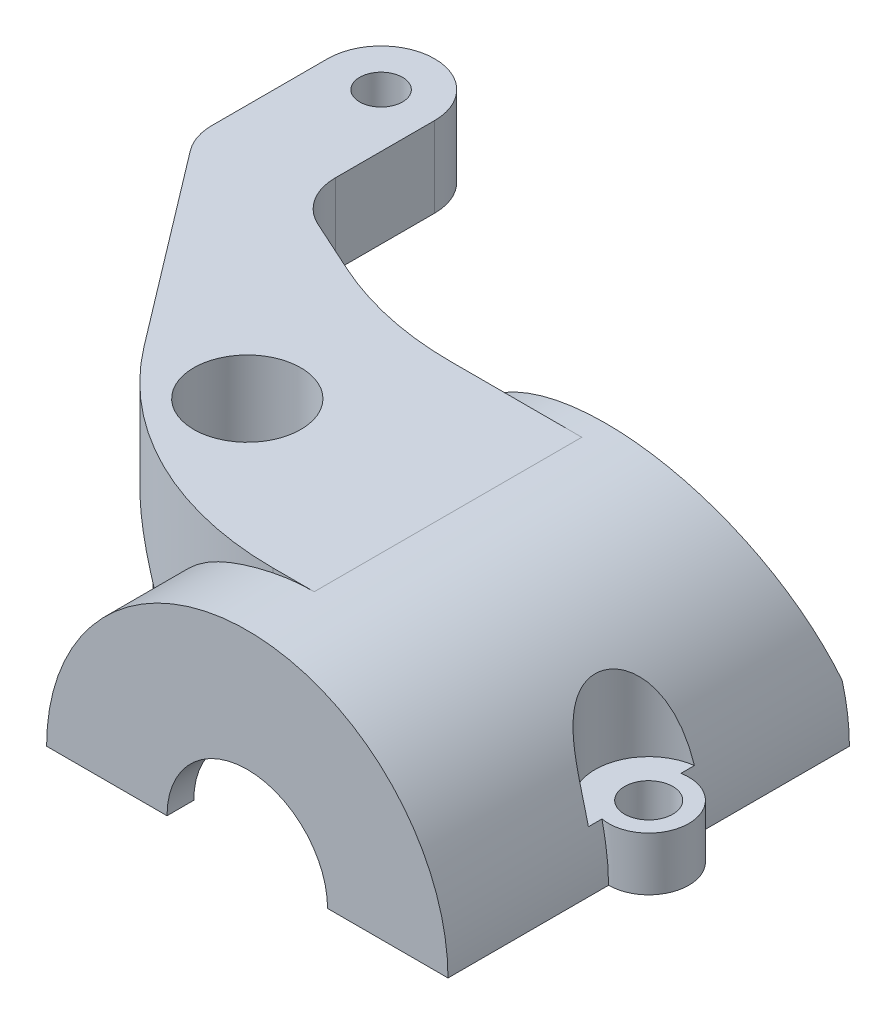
SolidWorks part; units mm, degrees
ref_plane "Front Plane" through (0, 0, 0) normal (0, 0, 1) x (1, 0, 0)
ref_plane "Top Plane" through (0, 0, 0) normal (0, 1, 0) x (1, 0, 0)
ref_plane "Right Plane" through (0, 0, 0) normal (1, 0, 0) x (0, 0, -1)
sketch "Sketch1" plane through (0, 0, 0) normal (0, 0, 1) x (1, 0, 0)
  circle A0 centre (0, 0) radius 9.525
  dimension "D1" = 19.05
extrude "Boss-Extrude1" add sketch "Sketch1" along normal blind 31.75
sketch "Sketch2" plane through (0, 0, 0) normal (0, 1, 0) x (1, 0, 0)
  line L0 (9.525, 0) -> (-9.525, 0) construction
  circle A0 centre (0, -6.35) radius 6.35
  dimension "D1" = 12.7
  dimension "D2" = 6.35
extrude "Boss-Extrude3" add sketch "Sketch2" along normal mid plane 19.05
sketch "Sketch3" plane through (0, 0, 0) normal (0, 1, 0) x (1, 0, 0)
  line L0 (-6.35, -6.35) -> (-9.525, -12.7)
  line L1 (-9.525, 0) -> (-9.525, -31.75) construction
  line L2 (-9.525, -12.7) -> (-12.728, -12.7)
  line L3 (-12.728, -12.7) -> (-12.728, 2.5774)
  line L4 (-12.728, 2.5774) -> (12.728, 2.5774)
  line L5 (12.728, 2.5774) -> (12.728, -12.7)
  line L6 (12.728, -12.7) -> (9.4319, -12.7)
  line L8 (6.35, -6.35) -> (9.4319, -12.7)
  arc A1 (6.35, -6.35) -> (-6.35, -6.35) centre (0, -6.35) ccw
extrude "Cut-Extrude1" cut sketch "Sketch3" against normal mid plane 19.05
sketch "Sketch17" plane through (0, 0, 0) normal (0, 1, 0) x (1, 0, 0)
  circle A0 centre (0, -6.35) radius 6.35
extrude "Boss-Extrude5" add sketch "Sketch17" against normal blind 10.16
sketch "Sketch18" plane through (0, 0, 0) normal (1, 0, 0) x (0, 0, -1)
  line L0 (-12.7, -10.16) -> (0, -10.16) construction
  line L1 (0.619, 11.9651) -> (-12.6697, 11.9651)
  line L2 (0.619, 11.9651) -> (0.619, 2.54)
  line L3 (0.619, 2.54) -> (-12.7, 2.54)
  line L5 (-12.7, 2.54) -> (-14.732, 9.525)
  line L6 (-12.7, 9.525) -> (-31.75, 9.525) construction
  line L7 (-14.732, 9.525) -> (-14.732, 11.9651)
  line L8 (-14.732, 11.9651) -> (-12.6697, 11.9651)
  dimension "D1" = 12.7
  dimension "D2" = 2.032
  dimension "D3" = 12.7
extrude "Cut-Extrude9" cut sketch "Sketch18" against normal through all both and the other way through all
sketch "Sketch19" plane through (0, -10.16, 0) normal (0, -1, 0) x (1, 0, 0)
  circle A0 centre (0, 6.35) radius 2.54
  dimension "D1" = 5.08
extrude "Cut-Extrude10" cut sketch "Sketch19" against normal through all
sketch "Sketch20" plane through (0, 0, 0) normal (1, 0, 0) x (0, 0, -1)
  line L0 (-32.7805, 0) -> (-32.7805, -11.6042)
  line L1 (-32.7805, 0) -> (-12.7, 0)
  line L4 (-12.7, 0) -> (-12.7, 4.1218)
  line L5 (-32.7805, -11.6042) -> (2.1772, -11.6042)
  line L6 (2.1772, -11.6042) -> (2.1772, 4.1218)
  line L7 (2.1772, 4.1218) -> (-12.7, 4.1218)
extrude "Cut-Extrude11" cut sketch "Sketch20" against normal through all both and the other way through all
sketch "Sketch21" plane through (0, 0, 0) normal (0, -1, 0) x (1, 0, 0)
  line L0 (3.81, 31.75) -> (3.81, 30.48)
  line L1 (9.525, 31.75) -> (-9.525, 31.75) construction
  line L2 (3.81, 30.48) -> (7.9375, 30.48)
  line L3 (7.9375, 30.48) -> (7.9375, 25.4)
  line L4 (7.9375, 25.4) -> (6.35, 25.4)
  line L5 (6.35, 25.4) -> (6.35, 15.24)
  line L6 (6.35, 15.24) -> (0, 15.24)
  line L7 (0, 33.6612) -> (0, 5.9676) construction
  line L8 (3.81, 31.75) -> (0, 31.75)
  line L9 (0, 15.24) -> (0, 31.75)
  dimension "D1" = 3.81
  dimension "D2" = 7.9375
  dimension "D3" = 6.35
  dimension "D4" = 5.08
  dimension "D5" = 10.16
  dimension "D6" = 1.27
sketch "Sketch22" plane through (0, 0, 0) normal (0, 1, 0) x (1, 0, 0)
  line L0 (9.525, -22.225) -> (19.05, -12.7) construction
  line L1 (9.525, -12.7) -> (9.525, -31.75) construction
  line L2 (19.05, -12.7) -> (19.05, 0) construction
  line L3 (0, 0) -> (0, -6.35) construction
  line L4 (16.51, -6.35) -> (16.51, -11.0645)
  line L5 (15.0211, -13.3768) -> (9.525, -15.875)
  line L6 (21.59, -6.35) -> (21.59, -11.8443)
  line L7 (21.0723, -13.3812) -> (9.525, -28.575)
  line L12 (-9.1801, -12.7) -> (9.1801, -12.7) construction
  line L13 (0, 0) -> (0, -40.5865) construction
  line L14 (-21.59, -6.35) -> (-21.59, -11.8443)
  line L15 (-16.51, -6.35) -> (-16.51, -11.0645)
  line L16 (-15.0211, -13.3768) -> (-9.525, -15.875)
  line L17 (-21.0723, -13.3812) -> (-9.525, -28.575)
  line L18 (-9.525, -15.875) -> (9.525, -15.875)
  line L19 (-9.525, -28.575) -> (9.525, -28.575)
  arc A0 (21.59, -6.35) -> (16.51, -6.35) centre (19.05, -6.35) ccw
  arc A1 (-21.59, -6.35) -> (-16.51, -6.35) centre (-19.05, -6.35) cw
  arc A2 (21.59, -11.8443) -> (21.0723, -13.3812) centre (19.05, -11.8443) cw
  arc A3 (16.51, -11.0645) -> (15.0211, -13.3768) centre (13.97, -11.0645) cw
  arc A4 (-21.59, -11.8443) -> (-21.0723, -13.3812) centre (-19.05, -11.8443) ccw
  arc A5 (-16.51, -11.0645) -> (-15.0211, -13.3768) centre (-13.97, -11.0645) ccw
  point P27 (21.59, -12.7)
  point P30 (16.51, -12.7)
  point P33 (-21.59, -12.7)
  point P36 (-16.51, -12.7)
  dimension "D5" = 5.08
  dimension "D7" = 2.54
  dimension "D1" = 6.35
  dimension "D2" = 12.7
  dimension "D3" = 6.35
  dimension "D4" = 19.05
  dimension "D6" = 6.35
extrude "Boss-Extrude6" add sketch "Sketch22" along normal blind 9.525
revolve "Cut-Revolve2" cut sketch "Sketch21" angle 360 about L7
sketch "Sketch23" plane through (0, 0, 28.575) normal (0, 0, 1) x (1, 0, 0)
  line L0 (-6.35, 0) -> (6.35, 0) construction
  line L1 (0, 9.525) -> (0, 12.7015)
  line L2 (0, 12.7015) -> (25.2029, 12.7015)
  line L3 (25.2029, 12.7015) -> (25.2029, -5.7658)
  line L4 (25.2029, -5.7658) -> (9.525, -5.7658)
  line L5 (9.525, -5.7658) -> (9.525, 0)
  arc A0 (9.525, 0) -> (0, 9.525) centre (0, 0) ccw
extrude "Cut-Extrude12" cut sketch "Sketch23" against normal through all
sketch "Sketch24" plane through (0, 0, 28.575) normal (0, 0, 1) x (1, 0, 0)
  line L0 (-22.6157, 5.715) -> (-11.5203, 5.715)
  line L1 (-11.5203, 5.715) -> (-8.9803, 3.175)
  line L2 (-9.525, 0) -> (-10.5272, -9.525)
  line L3 (-10.5272, -9.525) -> (-22.6157, -9.525)
  line L4 (-22.6157, -9.525) -> (-22.6157, 5.715)
  arc A0 (0, 9.525) -> (-9.525, 0) centre (0, 0) ccw construction
  arc A1 (-8.9803, 3.175) -> (-9.525, 0) centre (0, 0) ccw
  dimension "D1" = 3.81
  dimension "D2" = 2.54
  dimension "D3" = 2.54
extrude "Cut-Extrude13" cut sketch "Sketch24" against normal through all
fillet "Fillet1" radius 15.24 2 edges at (-9.525, 6.6224, 15.875) (-9.525, 6.6224, 28.575)
fillet "Fillet2" radius 10.16 1 edges at (-11.5203, 5.715, 20.0665)
sketch "Sketch25" plane through (0, 0, 0) normal (0, -1, 0) x (1, 0, 0)
  line L0 (-9.525, 12.7) -> (-9.525, 31.75) construction
  circle A0 centre (-9.525, 22.225) radius 3.175
  dimension "D1" = 6.35
extrude "Boss-Extrude7" add sketch "Sketch25" against normal through all
sketch "Sketch26" plane through (0, 0, 0) normal (0, -1, 0) x (1, 0, 0)
  line L0 (9.525, 12.7) -> (9.525, 31.75) construction
  circle A0 centre (9.525, 22.225) radius 1.905
  dimension "D1" = 3.81
extrude "Boss-Extrude8" add sketch "Sketch26" against normal blind 2.54
sketch "Sketch27" plane through (0, 2.54, 0) normal (0, 1, 0) x (1, 0, 0)
  circle A1 centre (9.525, -22.225) radius 2.54
  dimension "D1" = 5.08
extrude "Cut-Extrude14" cut sketch "Sketch27" along normal through all
sketch "Sketch28" plane through (0, 0, 0) normal (0, -1, 0) x (1, 0, 0)
  circle A0 centre (-9.525, 22.225) radius 1.143
  circle A1 centre (9.525, 22.225) radius 1.143
  circle A2 centre (-19.05, 6.35) radius 1.016
  dimension "D1" = 2.032
  dimension "D2" = 2.286
  dimension "D3" = 2.286
extrude "Cut-Extrude15" cut sketch "Sketch28" against normal through all
sketch "Sketch29" plane through (0, 9.525, 0) normal (0, 1, 0) x (1, 0, 0)
  circle A0 centre (-9.525, -22.225) radius 2.54
  dimension "D1" = 5.08
extrude "Cut-Extrude16" cut sketch "Sketch29" against normal up to surface (6.985 mm away)
